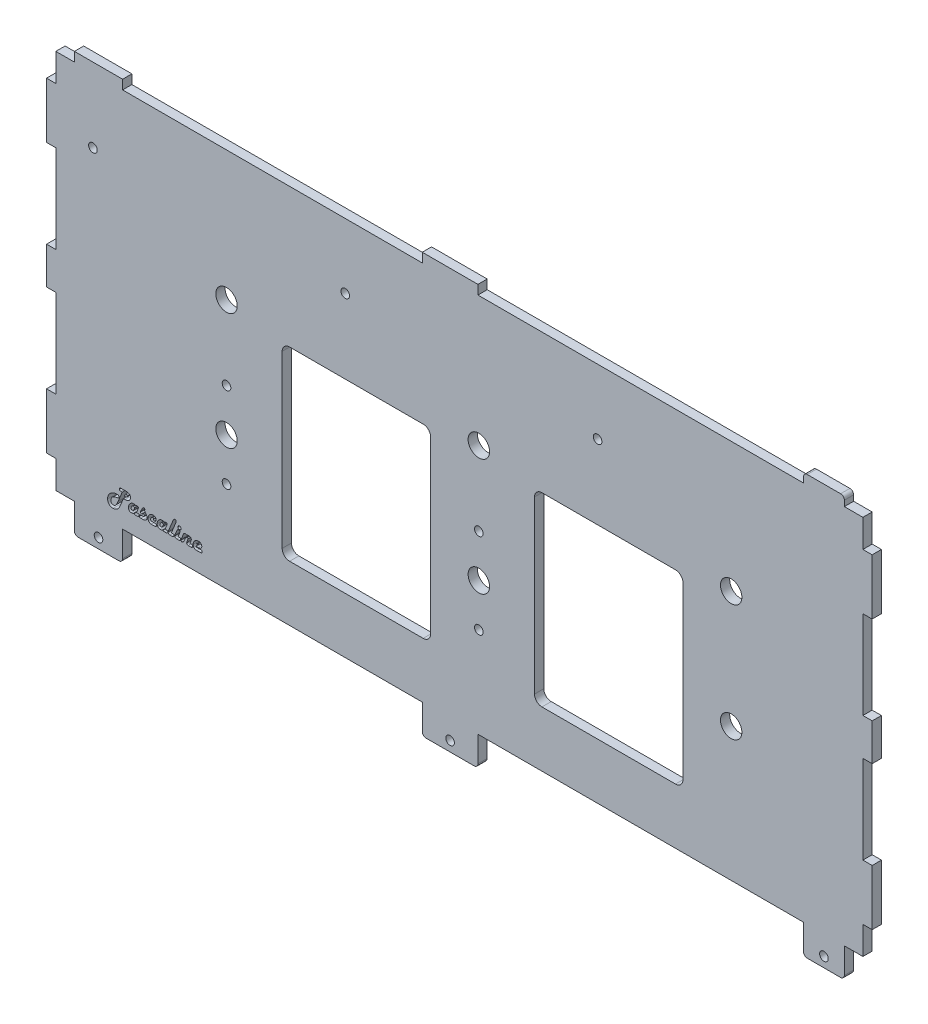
SolidWorks part; units mm, degrees
ref_plane "Front Plane" through (0, 0, 0) normal (0, 0, 1) x (1, 0, 0)
ref_plane "Top Plane" through (0, 0, 0) normal (0, 1, 0) x (1, 0, 0)
ref_plane "Right Plane" through (0, 0, 0) normal (1, 0, 0) x (0, 0, -1)
sketch "Sketch1" plane through (0, 0, 0) normal (0, 0, 1) x (1, 0, 0)
  line L0 (58.42, 45.72) -> (144.78, 45.72) construction
  line L1 (0, 0) -> (276.225, 0)
  line L2 (0, 0) -> (0, 130.175)
  line L3 (0, 130.175) -> (276.225, 130.175)
  line L4 (276.225, 0) -> (276.225, 130.175)
  line L5 (58.42, 85.725) -> (144.78, 85.725) construction
  line L6 (77.47, 19.05) -> (128.27, 19.05)
  line L7 (77.47, 19.05) -> (77.47, 82.55)
  line L8 (77.47, 82.55) -> (128.27, 82.55)
  line L9 (128.27, 19.05) -> (128.27, 82.55)
  line L10 (144.78, 45.72) -> (231.14, 45.72) construction
  line L12 (5.08, 100.33) -> (46.99, 100.33) construction
  line L13 (5.08, 100.33) -> (5.08, 7.62) construction
  line L14 (5.08, 7.62) -> (46.99, 7.62) construction
  line L15 (46.99, 100.33) -> (46.99, 7.62) construction
  line L16 (144.78, 85.725) -> (231.14, 85.725) construction
  line L18 (264.795, 7.62) -> (240.03, 7.62) construction
  line L19 (240.03, 100.33) -> (240.03, 7.62) construction
  line L20 (264.795, 100.33) -> (264.795, 7.62) construction
  line L21 (264.795, 100.33) -> (240.03, 100.33) construction
  line L22 (214.63, 19.05) -> (163.83, 19.05)
  line L23 (163.83, 19.05) -> (163.83, 82.55)
  line L24 (214.63, 19.05) -> (214.63, 82.55)
  line L25 (214.63, 82.55) -> (163.83, 82.55)
  circle A0 centre (58.42, 85.725) radius 3.6703
  circle A1 centre (58.42, 45.72) radius 3.6703
  circle A2 centre (144.78, 45.72) radius 3.6703
  circle A3 centre (144.78, 85.725) radius 3.6703
  circle A4 centre (231.14, 85.725) radius 3.6703
  circle A5 centre (231.14, 45.72) radius 3.6703
  dimension "D3" = 276.225
  dimension "D5" = 7.3406
  dimension "D1" = 130.175
  dimension "D2" = 86.36
  dimension "D4" = 45.72
  dimension "D6" = 85.725
  dimension "D7" = 45.085
  dimension "D8" = 19.05
  dimension "D9" = 19.05
  dimension "D10" = 41.91
  dimension "D11" = 11.43
  dimension "D12" = 92.71
  dimension "D13" = 63.5
  dimension "D14" = 7.62
  dimension "D15" = 19.05
  dimension "D16" = 8.89
  dimension "D17" = 11.43
  dimension "D18" = 50.8
  dimension "D20" = 44.45
extrude "Boss-Extrude1" add sketch "Sketch1" along normal blind 3.175
fillet "Fillet1" radius 2.54 8 edges at (77.47, 19.05, 1.5875) (128.27, 19.05, 1.5875) (128.27, 82.55, 1.5875) (77.47, 82.55, 1.5875) (163.83, 19.05, 1.5875) (214.63, 19.05, 1.5875) (214.63, 82.55, 1.5875) (163.83, 82.55, 1.5875)
sketch "Sketch4" plane through (0, 0, 0) normal (0, 0, 1) x (1, 0, 0)
  line L1 (138.1125, 130.175) -> (138.1125, 0) construction
  line L6 (276.225, 130.175) -> (0, 130.175) construction
  line L7 (0, 0) -> (276.225, 0) construction
  line L8 (0, 65.0875) -> (276.225, 65.0875) construction
  line L9 (0, 130.175) -> (0, 0) construction
  line L10 (276.225, 0) -> (276.225, 130.175) construction
  line L11 (276.225, 28.575) -> (279.4, 28.575)
  line L12 (276.225, 120.65) -> (279.4, 120.65)
  line L13 (276.225, 120.65) -> (276.225, 101.6)
  line L15 (276.225, 101.6) -> (279.4, 101.6)
  line L17 (279.4, 120.65) -> (279.4, 101.6)
  line L18 (276.225, 9.525) -> (279.4, 9.525)
  line L19 (276.225, 9.525) -> (276.225, 28.575)
  line L20 (279.4, 9.525) -> (279.4, 28.575)
  line L21 (-3.175, 71.4375) -> (-3.175, 58.7375)
  line L22 (276.225, 71.4375) -> (279.4, 71.4375)
  line L23 (276.225, 71.4375) -> (276.225, 58.7375)
  line L24 (276.225, 58.7375) -> (279.4, 58.7375)
  line L25 (279.4, 71.4375) -> (279.4, 58.7375)
  line L26 (0, 58.7375) -> (-3.175, 58.7375)
  line L27 (0, 71.4375) -> (0, 58.7375)
  line L28 (0, 71.4375) -> (-3.175, 71.4375)
  line L29 (-3.175, 9.525) -> (-3.175, 28.575)
  line L30 (0, 9.525) -> (0, 28.575)
  line L31 (0, 9.525) -> (-3.175, 9.525)
  line L32 (-3.175, 120.65) -> (-3.175, 101.6)
  line L33 (0, 101.6) -> (-3.175, 101.6)
  line L34 (0, 120.65) -> (0, 101.6)
  line L35 (0, 120.65) -> (-3.175, 120.65)
  line L36 (0, 28.575) -> (-3.175, 28.575)
  line L38 (6.35, 0) -> (22.86, 0)
  line L39 (6.35, 0) -> (6.35, -10.033)
  line L43 (6.35, -10.033) -> (22.86, -10.033)
  line L44 (22.86, 0) -> (22.86, -10.033)
  line L45 (125.4125, 0) -> (144.4625, 0)
  line L46 (125.4125, 0) -> (125.4125, -10.033)
  line L47 (125.4125, -10.033) -> (144.4625, -10.033)
  line L48 (144.4625, 0) -> (144.4625, -10.033)
  line L49 (255.905, 0) -> (269.875, 0)
  line L50 (255.905, 0) -> (255.905, -10.033)
  line L51 (255.905, -10.033) -> (269.875, -10.033)
  line L52 (269.875, 0) -> (269.875, -10.033)
  line L53 (6.35, 130.175) -> (22.86, 130.175)
  line L54 (6.35, 130.175) -> (6.35, 133.35)
  line L55 (6.35, 133.35) -> (22.86, 133.35)
  line L57 (22.86, 130.175) -> (22.86, 133.35)
  line L59 (125.4125, 133.35) -> (144.4625, 133.35)
  line L60 (125.4125, 133.35) -> (125.4125, 130.175)
  line L61 (125.4125, 130.175) -> (144.4625, 130.175)
  line L62 (144.4625, 133.35) -> (144.4625, 130.175)
  line L63 (255.905, 133.35) -> (269.875, 133.35)
  line L64 (255.905, 133.35) -> (255.905, 130.175)
  line L65 (255.905, 130.175) -> (269.875, 130.175)
  line L66 (269.875, 133.35) -> (269.875, 130.175)
  point P24 (276.225, 65.0875)
  point P62 (134.9375, -10.033)
  dimension "D1" = 3.175
  dimension "D2" = 9.525
  dimension "D3" = 19.05
  dimension "D4" = 10.033
  dimension "D5" = 6.35
  dimension "D6" = 6.35
  dimension "D7" = 3.175
  dimension "D8" = 16.51
  dimension "D9" = 19.05
  dimension "D10" = 13.97
  dimension "D11" = 282.575
  dimension "D12" = 3.175
  dimension "D13" = 12.7
extrude "Boss-Extrude2" add sketch "Sketch4" along normal blind 3.175
hole_wizard "#4 Clearance Hole1" positions "Sketch3" profile "Sketch2" hole size "#4" standard "ANSI Inch"
sketch "Sketch3" plane through (0, 0, 3.175) normal (0, 0, 1) x (1, 0, 0)
  line L1 (0, 0) -> (6.35, 0) construction
  line L2 (58.42, 45.72) -> (109.22, 45.72) construction
  line L3 (144.78, 45.72) -> (195.58, 45.72) construction
  line L9 (144.4625, 0) -> (255.905, 0) construction
  line L10 (125.4125, -10.033) -> (144.4625, -10.033) construction
  line L11 (6.35, -10.033) -> (22.86, -10.033) construction
  line L12 (255.905, -10.033) -> (269.875, -10.033) construction
  line L13 (12.7, 107.95) -> (58.42, 107.95) construction
  line L15 (99.06, 107.95) -> (144.78, 107.95) construction
  line L17 (185.42, 107.95) -> (231.14, 107.95) construction
  circle A0 centre (144.78, 85.725) radius 3.6703 construction
  point P0 (99.06, 107.95)
  point P15 (12.7, 107.95)
  point P22 (185.42, 107.95)
  point P40 (134.9375, -6.604)
  point P47 (14.605, -6.604)
  point P49 (262.89, -6.604)
  point P61 (58.42, 60.325)
  point P63 (58.42, 31.115)
  point P70 (144.78, 60.325)
  point P72 (144.78, 31.115)
  point P80 (134.9375, -10.033)
  point P85 (14.605, -10.033)
  point P89 (262.89, -10.033)
  dimension "D1" = 107.95
  dimension "D2" = 45.72
  dimension "D6" = 14.605
  dimension "2" = 50.8
  dimension "D7" = 6.604
  dimension "D8" = 29.21
sketch "Sketch2" plane through (99.06, 107.95, 3.175) normal (1, 0, 0) x (0, -1, 0)
  line L0 (0, 0) -> (0, 3.1751)
  line L1 (0, 3.1751) -> (1.4732, 3.1751)
  line L2 (1.4732, 3.1751) -> (1.4732, 0)
  line L5 (1.4732, 0) -> (0, 0)
  line L11 (0, -6.35) -> (0, 107.95) construction
  dimension "Thru Hole Dia." = 2.9464
  dimension "Thru Hole Depth" = 3.1751
fillet "Fillet2" radius 1.27 8 edges at (255.905, 133.35, 1.5875) (269.875, 133.35, 1.5875) (269.875, -10.033, 1.5875) (255.905, -10.033, 1.5875) (144.4625, -10.033, 1.5875) (125.4125, -10.033, 1.5875) (22.86, -10.033, 1.5875) (6.35, -10.033, 1.5875)
sketch "Sketch5" plane through (0, 0, 3.175) normal (0, 0, 1) x (1, 0, 0)
  text T0 "Pascaline" font "Harlow Solid Italic" height in points 18
  dimension "D1" = 6.35
  dimension "D2" = 17.78
extrude "Cut-Extrude3" cut sketch "Sketch5" against normal through all
